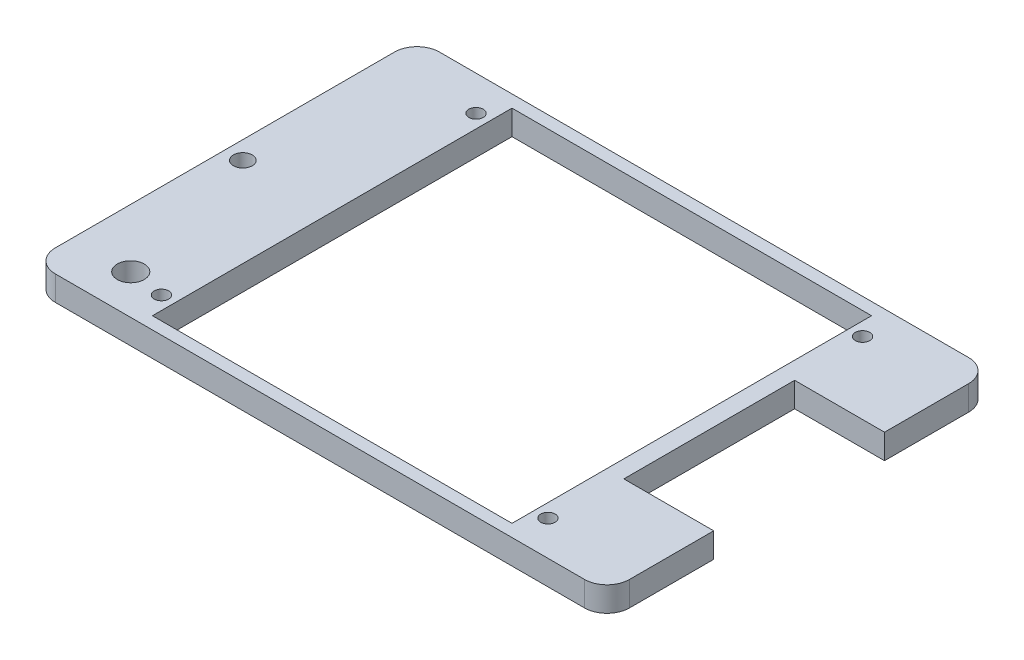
SolidWorks part; units mm, degrees
ref_plane "Front Plane" through (0, 0, 0) normal (0, 0, 1) x (1, 0, 0)
ref_plane "Top Plane" through (0, 0, 0) normal (0, 1, 0) x (1, 0, 0)
ref_plane "Right Plane" through (0, 0, 0) normal (1, 0, 0) x (0, 0, -1)
sketch "Sketch1" plane through (0, 0, 0) normal (0, 1, 0) x (1, 0, 0)
  line L1 (0, 42.74) -> (63.88, 42.74)
  line L3 (63.88, -42.74) -> (-63.88, -42.74)
  line L4 (-63.88, -33.9411) -> (-63.88, 42.74)
  line L5 (-63.88, 42.74) -> (0, 42.74)
  line L19 (43.88, 18) -> (43.88, 19)
  line L20 (43.88, 19) -> (63.88, 19)
  line L22 (43.88, 18) -> (43.88, -18)
  line L24 (63.88, -19) -> (63.88, -42.74)
  line L25 (63.88, 19) -> (63.88, 42.74)
  line L26 (43.88, -18) -> (43.88, -19)
  line L27 (43.88, -19) -> (63.88, -19)
  line L28 (-63.88, -42.74) -> (-63.88, -33.9411)
  line L30 (0, 40) -> (40, 40)
  line L31 (40, 40) -> (40, -40)
  line L32 (40, -40) -> (-40, -40)
  line L33 (-40, -40) -> (-40, 40)
  line L34 (-40, 40) -> (0, 40)
  circle A9 centre (-59.88, 0) radius 2.1
  circle A10 centre (-50.88, -33.9411) radius 3
  circle A11 centre (43, 35) radius 1.6
  circle A12 centre (43, -35) radius 1.6
  circle A13 centre (-43, -35) radius 1.6
  circle A14 centre (-43, 35) radius 1.6
  point P20 (0, 39)
  point P21 (39, 0)
  point P26 (-39, 0)
extrude "Boss-Extrude1" add sketch "Sketch1" along normal blind 5.5
fillet "Fillet1" radius 5 1 edges at (-63.88, 2.75, 42.74)
fillet "Fillet2" radius 5 3 edges at (-63.88, 2.75, -42.74) (63.88, 2.75, -42.74) (63.88, 2.75, 42.74)
